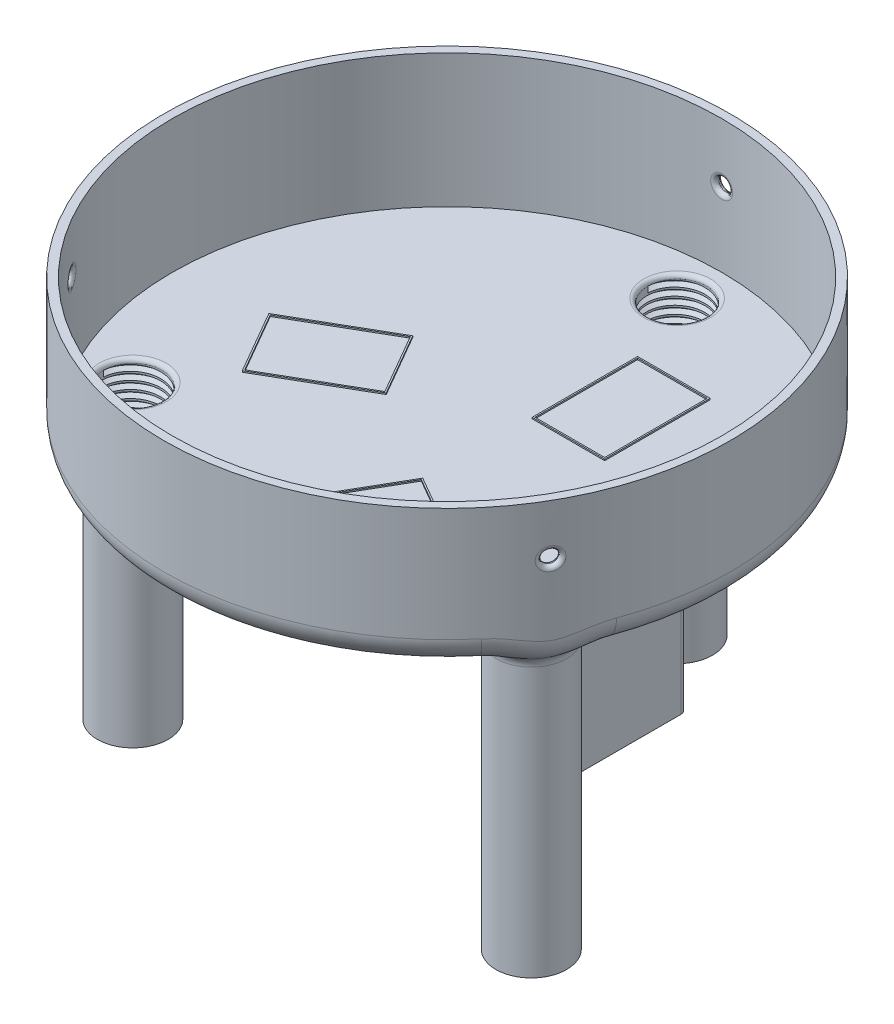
SolidWorks part; units mm, degrees
ref_plane "Front Plane" through (0, 0, 0) normal (0, 0, 1) x (1, 0, 0)
ref_plane "Top Plane" through (0, 0, 0) normal (0, 1, 0) x (1, 0, 0)
ref_plane "Right Plane" through (0, 0, 0) normal (1, 0, 0) x (0, 0, -1)
sketch "Sketch2" plane through (0, 0, 0) normal (0, 1, 0) x (1, 0, 0)
  circle A0 centre (0, 0) radius 101.6
  dimension "D1" = 203.2
extrude "Boss-Extrude1" add sketch "Sketch2" along normal blind 76.2
shell "Shell1" thickness 3
sketch "Sketch3" plane through (0, 3, 0) normal (0, 1, 0) x (1, 0, 0)
  line L0 (0, 0) -> (0, 101.6) construction
  line L1 (0, 0) -> (-87.9882, -50.8) construction
  line L2 (0, 0) -> (87.9882, -50.8) construction
  circle A0 centre (0, 0) radius 101.6 construction
  circle A1 centre (-71.4904, -41.275) radius 12.7
  circle A2 centre (71.4904, -41.275) radius 12.7
  circle A3 centre (0, 82.55) radius 12.7
  dimension "D3" = 25.4
  dimension "D1" = 120
  dimension "D2" = 120
  dimension "D4" = 82.55
  dimension "D5" = 82.55
  dimension "D6" = 82.55
extrude "Boss-Extrude2" add sketch "Sketch3" against normal blind 104.6
sketch "Sketch4" plane through (0, -101.6, 0) normal (0, -1, 0) x (1, 0, 0)
  circle A0 centre (-71.4904, 41.275) radius 10.5
  circle A1 centre (71.4904, 41.275) radius 10.5
  circle A2 centre (0, -82.55) radius 10.5
  dimension "D1" = 21
  dimension "D2" = 21
  dimension "D3" = 21
extrude "Cut-Extrude2" cut sketch "Sketch4" against normal through all
sketch "Sketch5" plane through (0, 0, 0) normal (0, -1, 0) x (1, 0, 0)
  line L1 (63.5, -22.5) -> (-63.5, -22.5)
  line L2 (63.5, -22.5) -> (63.5, 22.5)
  line L3 (63.5, 22.5) -> (-63.5, 22.5)
  line L4 (-63.5, -22.5) -> (-63.5, 22.5)
  line L5 (63.5, -22.5) -> (-63.5, 22.5) construction
  line L6 (63.5, 22.5) -> (-63.5, -22.5) construction
  point P0 (0, 0)
  dimension "D1" = 127
  dimension "D2" = 45
extrude "Boss-Extrude3" add sketch "Sketch5" along normal blind 63.5
sketch "Sketch6" plane through (0, 0, 22.5) normal (0, 0, 1) x (1, 0, 0)
  line L0 (63.5, -63.5) -> (-63.5, -63.5) construction
  line L2 (-62.23, -63.5) -> (62.23, -63.5)
  arc A0 (-62.23, -63.5) -> (62.23, -63.5) centre (0, -63.5) cw
  dimension "D1" = 62.23
extrude "Cut-Extrude3" cut sketch "Sketch6" against normal up to surface (45 mm away)
sketch "Sketch7" plane through (0, -63.5, 0) normal (0, -1, 0) x (1, 0, 0)
  line L0 (-62.23, -22.5) -> (-62.23, 22.5) construction
  line L1 (-62.23, -15.875) -> (-62.73, -15.875)
  line L2 (-62.23, -15.875) -> (-62.23, 15.875)
  line L3 (-62.23, 15.875) -> (-62.73, 15.875)
  line L5 (-62.73, 15.875) -> (-62.73, 16.256)
  line L6 (-62.73, -16.256) -> (-63.23, -16.256)
  line L7 (-62.73, -16.256) -> (-62.73, -15.875)
  line L8 (-62.73, 16.256) -> (-63.23, 16.256)
  line L9 (-63.23, -16.256) -> (-63.23, 16.256)
  point P6 (-62.23, 0)
  point P12 (-63.23, 0)
  dimension "D1" = 31.75
  dimension "D2" = 0.5
  dimension "D3" = 32.512
  dimension "D4" = 0.5
sketch "Sketch9" plane through (0, 0, 0) normal (0, 0, 1) x (1, 0, 0)
  line L0 (-62.73, -63.5) -> (-63.23, -63.5) construction
  line L1 (-62.23, -63.5) -> (-62.73, -63.5) construction
  line L2 (63.5, -63.5) -> (62.23, -63.5) construction
  arc A0 (-62.73, -63.5) -> (62.73, -63.5) centre (0, -63.5) cw
  arc A1 (62.23, -63.5) -> (-62.23, -63.5) centre (0, -63.5) ccw construction
  dimension "D1" = 0.5
sweep "Cut-Sweep2" cut profiles "Sketch7" path "Sketch9"
fillet "Fillet1" radius 5 7 edges at (-71.4904, 0, 53.975) (71.4904, 0, 53.975) (0, 0, -69.85) (63.5, 0, 0) (-63.5, 0, 0) (0, 0, -22.5) (0, 0, 22.5)
fillet "Fillet2" radius 2 8 edges at (64.9645, -1.4645, -23.9645) (64.4305, -2.0949, 23.4305) (-64.4305, -2.0949, 23.4305) (-64.9645, -1.4645, -23.9645) (63.5, -34.25, -22.5) (63.5, -34.25, 22.5) (-63.5, -34.25, 22.5) (-63.5, -34.25, -22.5)
ref_plane "Plane1" through (0, 0, -101.6) normal (0, 0, 1) x (1, 0, 0)
sketch "Sketch10" plane through (0, 0, -101.6) normal (0, 0, 1) x (1, 0, 0)
  circle A0 centre (0, 29.7) radius 2.5
  dimension "D1" = 5
  dimension "D2" = 29.7
extrude "Cut-Extrude4" cut sketch "Sketch10" along normal blind 76.2
sketch "Sketch11" plane through (0, 3, 0) normal (0, 1, 0) x (1, 0, 0)
  line L0 (0, 0) -> (0, 101.6) construction
  line L1 (0, 0) -> (87.9882, -50.8) construction
  circle A0 centre (0, 0) radius 101.6 construction
  dimension "D1" = 120
ref_plane "Plane2" through (87.9882, 3, 50.8) normal (0.866, 0, 0.5) x (0.5, 0, -0.866)
sketch "Sketch12" plane through (87.9882, 3, 50.8) normal (0.866, 0, 0.5) x (0.5, 0, -0.866)
  line L0 (0, 0) -> (87.9882, 0) construction
  line L1 (0, -3) -> (0, 29.7) construction
  circle A0 centre (0, 29.7) radius 2.5
  dimension "D1" = 5
  dimension "D2" = 29.7
extrude "Cut-Extrude5" cut sketch "Sketch12" against normal blind 76.2
mirror "Mirror1" about plane through (0, 0, 0) normal (1, 0, 0) of "Cut-Extrude5"
sketch "Sketch13" plane through (0, 3, 0) normal (0, 1, 0) x (1, 0, 0)
  line L0 (0, 0) -> (0, 101.6) construction
  line L1 (0, 0) -> (-87.9882, -50.8) construction
  line L2 (0, 0) -> (87.9882, -50.8) construction
  line L3 (12, 37.96) -> (91, 37.96) construction
  line L4 (37, 19.56) -> (12, 19.56)
  line L5 (37, 19.56) -> (37, 56.36)
  line L6 (37, 56.36) -> (12, 56.36)
  line L7 (12, 19.56) -> (12, 56.36)
  line L8 (37, 19.56) -> (12, 56.36) construction
  line L9 (37, 56.36) -> (12, 19.56) construction
  line L10 (37.5, 19.06) -> (11.5, 19.06)
  line L11 (37.5, 19.06) -> (37.5, 56.86)
  line L12 (37.5, 56.86) -> (11.5, 56.86)
  line L13 (11.5, 19.06) -> (11.5, 56.86)
  line L14 (37.5, 19.06) -> (11.5, 56.86) construction
  line L15 (37.5, 56.86) -> (11.5, 19.06) construction
  line L16 (10.9394, -20.1723) -> (42.8092, -38.5723)
  line L17 (42.8092, -38.5723) -> (30.3092, -60.2229)
  line L18 (30.3092, -60.2229) -> (-1.5606, -41.8229)
  line L19 (-1.5606, -41.8229) -> (10.9394, -20.1723)
  line L20 (26.8743, -29.3723) -> (-12.6257, -97.7883) construction
  line L21 (10.7564, -19.4893) -> (-2.2436, -42.0059)
  line L22 (-2.2436, -42.0059) -> (30.4922, -60.9059)
  line L23 (30.4922, -60.9059) -> (43.4922, -38.3893)
  line L24 (43.4922, -38.3893) -> (10.7564, -19.4893)
  line L25 (-54.8092, -17.7877) -> (-22.9394, 0.6123)
  line L26 (-22.9394, 0.6123) -> (-35.4394, 22.263)
  line L27 (-35.4394, 22.263) -> (-67.3092, 3.863)
  line L28 (-67.3092, 3.863) -> (-54.8092, -17.7877)
  line L29 (-35.2564, 22.946) -> (-67.9922, 4.046)
  line L30 (-67.9922, 4.046) -> (-54.9922, -18.4707)
  line L31 (-54.9922, -18.4707) -> (-22.2564, 0.4293)
  line L32 (-22.2564, 0.4293) -> (-35.2564, 22.946)
  line L33 (-38.8743, -8.5877) -> (-78.3743, 59.8283) construction
  circle A0 centre (0, 0) radius 101.6 construction
  circle A1 centre (0, 0) radius 98.6 construction
  circle A2 centre (0, 0) radius 98.6 construction
  point P5 (24.5, 37.96)
  point P12 (24.5, 37.96)
  dimension "D1" = 120
  dimension "D2" = 120
  dimension "D3" = 36.8
  dimension "D4" = 25
  dimension "D5" = 12
  dimension "D6" = 0.5
  dimension "D7" = 0.5
  dimension "D8" = 79
  dimension "D9" = 36.8
  dimension "D10" = 25
  dimension "D11" = 12
  dimension "D12" = 79
  dimension "D13" = 0.5
  dimension "D14" = 0.5
  dimension "D15" = 0.5
  dimension "D16" = 0.5
  dimension "D17" = 12
  dimension "D18" = 36.8
  dimension "D19" = 25
  dimension "D20" = 0.5
  dimension "D21" = 0.5
  dimension "D22" = 0.5
  dimension "D23" = 0.5
  dimension "D24" = 79
extrude "Boss-Extrude4" add sketch "Sketch13" along normal blind 0.5
sketch "Sketch15" plane through (0, 76.2, 0) normal (0, 1, 0) x (1, 0, 0)
  circle A0 centre (0, 0) radius 101.6
  dimension "D1" = 203.2
extrude "Cut-Extrude6" cut sketch "Sketch15" against normal blind 25.4
fillet "Fillet3" radius 1.5 9 edges at (86.7464, 33.2742, 52.8926) (84.1475, 33.2741, 51.3922) (-0.5742, 27.2668, -101.5984) (-0.5741, 27.2668, -98.5983) (-89.1795, 32.1258, 48.6782) (-86.5807, 32.1259, 47.1778) (-71.4904, 3, 51.775) (71.4904, 3, 51.775) (0, 3, -72.05)
fillet "Fillet4" radius 10 1 edges at (0, 0, 101.6)
thread "Thread1" pitch 2.8222 start angle 0, offset 0, length 0, pitch 2.8222, diameter 21
ref_plane "Plane4" through (-81.9904, 1.5, 41.275) normal (0, 0, 1) x (-1, 0, 0)
sketch "Thread Profile2" plane through (-81.9904, 1.5, 41.275) normal (0, 0, 1) x (-1, 0, 0)
  line L0 (0, 0) -> (0, 2.8222) construction
  line L1 (0, 0) -> (1.5276, 0.8819)
  line L2 (1.5276, 0.8819) -> (1.5276, 1.2347)
  line L3 (1.5276, 1.2347) -> (0, 2.1167)
  line L4 (1.5276, 1.0583) -> (0, 1.0583) construction
  line L11 (0, 0) -> (0, 2.1167)
  point P2 (0, 0)
  dimension "Pitch" = 2.8222
  dimension "Profile_Angle" = 60
  dimension "Profile_Land" = 0.3528
  dimension "Profile_Height" = 1.5276
thread "Thread2" pitch 2.8222 start angle 0, offset 0, length 0, pitch 2.8222, diameter 21
ref_plane "Plane5" through (-10.5, 1.5, -82.55) normal (0, 0, 1) x (-1, 0, 0)
sketch "Thread Profile3" plane through (-10.5, 1.5, -82.55) normal (0, 0, 1) x (-1, 0, 0)
  line L0 (0, 0) -> (0, 2.8222) construction
  line L1 (0, 0) -> (1.5276, 0.8819)
  line L2 (1.5276, 0.8819) -> (1.5276, 1.2347)
  line L3 (1.5276, 1.2347) -> (0, 2.1167)
  line L4 (1.5276, 1.0583) -> (0, 1.0583) construction
  line L11 (0, 0) -> (0, 2.1167)
  point P2 (0, 0)
  dimension "Pitch" = 2.8222
  dimension "Profile_Angle" = 60
  dimension "Profile_Land" = 0.3528
  dimension "Profile_Height" = 1.5276
thread "Thread3" pitch 2.8222 start angle 0, offset 0, length 0, pitch 2.8222, diameter 21
ref_plane "Plane6" through (60.9904, 1.5, 41.275) normal (0, 0, 1) x (-1, 0, 0)
sketch "Thread Profile4" plane through (60.9904, 1.5, 41.275) normal (0, 0, 1) x (-1, 0, 0)
  line L0 (0, 0) -> (0, 2.8222) construction
  line L1 (0, 0) -> (1.5276, 0.8819)
  line L2 (1.5276, 0.8819) -> (1.5276, 1.2347)
  line L3 (1.5276, 1.2347) -> (0, 2.1167)
  line L4 (1.5276, 1.0583) -> (0, 1.0583) construction
  line L11 (0, 0) -> (0, 2.1167)
  point P2 (0, 0)
  dimension "Pitch" = 2.8222
  dimension "Profile_Angle" = 60
  dimension "Profile_Land" = 0.3528
  dimension "Profile_Height" = 1.5276
